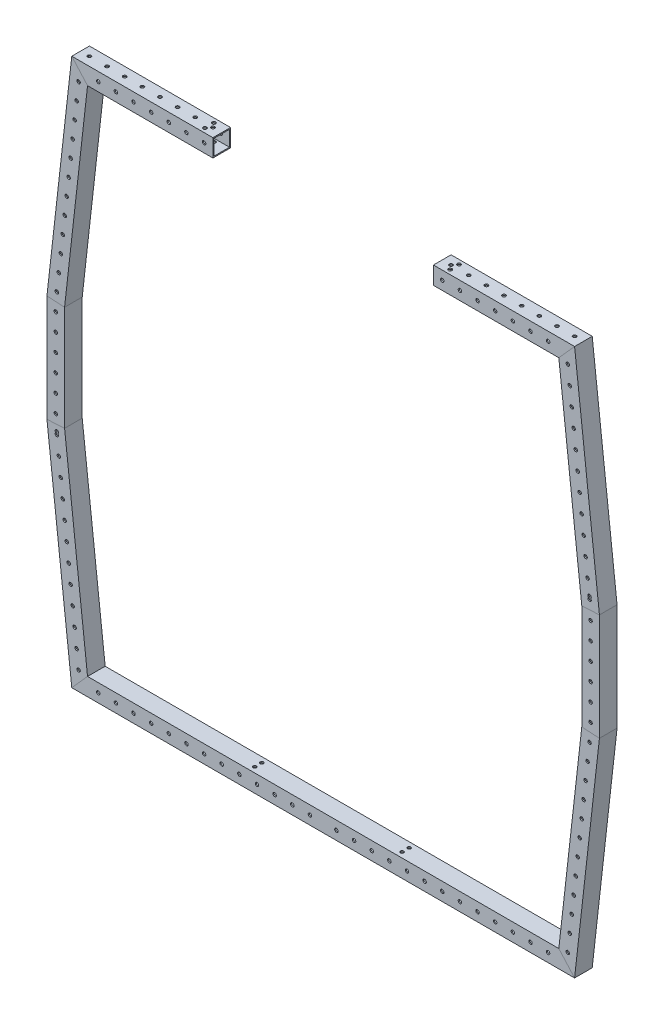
SolidWorks part; units mm, degrees
ref_plane "Front Plane" through (0, 0, 0) normal (0, 0, 1) x (1, 0, 0)
ref_plane "Top Plane" through (0, 0, 0) normal (0, 1, 0) x (1, 0, 0)
ref_plane "Right Plane" through (0, 0, 0) normal (1, 0, 0) x (0, 0, -1)
ref_plane "Plane2" through (0, 0, 25.4) normal (0, 0, 1) x (1, 0, 0)
sketch "Sketch2" plane through (0, 0, 25.4) normal (0, 0, 1) x (1, 0, 0)
  line L0 (-385.0161, -304.8) -> (-385.0161, -457.2)
  line L1 (385.0161, -304.8) -> (385.0161, -457.2)
  line L12 (-350.6032, -762) -> (350.6032, -762)
  line L13 (350.6032, -762) -> (393.6193, -381)
  line L14 (393.6193, -381) -> (350.6032, 0)
  line L15 (350.6032, 0) -> (-350.6032, 0)
  line L16 (-350.6032, 0) -> (-393.6193, -381)
  line L17 (-393.6193, -381) -> (-350.6032, -762)
  line L18 (-350.6032, -762) -> (350.6032, -762)
  line L19 (350.6032, -762) -> (385.0161, -457.2)
  line L20 (385.0161, -304.8) -> (350.6032, 0)
  line L21 (350.6032, 0) -> (-350.6032, 0)
  line L22 (-350.6032, 0) -> (-385.0161, -304.8)
  line L23 (-385.0161, -457.2) -> (-350.6032, -762)
  dimension "D2" = 152.4
  dimension "D1" = 12.7
sketch "Sketch13" plane through (0, 0, 0) normal (1, 0, 0) x (0, 0, -1)
  line L0 (-25.4, 0) -> (-25.4, -304.8) construction
  line L1 (-38.1, 12.7) -> (-12.7, 12.7)
  line L2 (-38.1, 12.7) -> (-38.1, -12.7)
  line L3 (-38.1, -12.7) -> (-12.7, -12.7)
  line L4 (-12.7, 12.7) -> (-12.7, -12.7)
  line L5 (-38.1, 12.7) -> (-12.7, -12.7) construction
  line L6 (-38.1, -12.7) -> (-12.7, 12.7) construction
  line L7 (-36.5125, 11.1125) -> (-14.2875, 11.1125)
  line L8 (-14.2875, 11.1125) -> (-14.2875, -11.1125)
  line L9 (-36.5125, -11.1125) -> (-14.2875, -11.1125)
  line L10 (-36.5125, 11.1125) -> (-36.5125, -11.1125)
  point P0 (-25.4, 0)
  dimension "D1" = 25.4
  dimension "D2" = 25.4
  dimension "D3" = 1.5875
sweep "Sweep1" add profiles "Sketch13" path "Sketch2"
sketch "Sketch14" plane through (0, 0, 38.1) normal (0, 0, 1) x (1, 0, 0)
  line L1 (-158.75, -620.3213) -> (158.75, -620.3213)
  line L2 (-158.75, -620.3213) -> (-158.75, 76.1802)
  line L3 (-158.75, 76.1802) -> (158.75, 76.1802)
  line L4 (158.75, -620.3213) -> (158.75, 76.1802)
  line L5 (-158.75, -620.3213) -> (158.75, 76.1802) construction
  line L6 (-158.75, 76.1802) -> (158.75, -620.3213) construction
  point P0 (0, -272.0706)
  dimension "D1" = 317.5
extrude "Cut-Extrude1" cut sketch "Sketch14" against normal through all
sketch "Sketch15" plane through (0, -774.7, 0) normal (0, -1, 0) x (1, 0, 0)
  line L0 (-361.95, 38.1) -> (-361.95, 12.7) construction
  line L1 (361.95, 38.1) -> (-361.95, 38.1) construction
  line L2 (0, 12.7) -> (0, 38.1) construction
  line L3 (361.95, 12.7) -> (-361.95, 12.7) construction
  circle A0 centre (-349.25, 25.4) radius 2.4892
  circle A1 centre (-323.85, 25.4) radius 2.4892
  circle A2 centre (-298.45, 25.4) radius 2.4892
  circle A3 centre (-273.05, 25.4) radius 2.4892
  circle A4 centre (-247.65, 25.4) radius 2.4892
  circle A5 centre (-222.25, 25.4) radius 2.4892
  circle A6 centre (-196.85, 25.4) radius 2.4892
  circle A7 centre (-171.45, 25.4) radius 2.4892
  circle A8 centre (-146.05, 25.4) radius 2.4892
  circle A9 centre (-120.65, 25.4) radius 2.4892
  circle A10 centre (-95.25, 25.4) radius 2.4892
  circle A11 centre (-69.85, 25.4) radius 2.4892
  circle A12 centre (-44.45, 25.4) radius 2.4892
  circle A13 centre (-19.05, 25.4) radius 2.4892
  circle A14 centre (19.05, 25.4) radius 2.4892
  circle A15 centre (44.45, 25.4) radius 2.4892
  circle A16 centre (69.85, 25.4) radius 2.4892
  circle A17 centre (95.25, 25.4) radius 2.4892
  circle A18 centre (120.65, 25.4) radius 2.4892
  circle A19 centre (146.05, 25.4) radius 2.4892
  circle A20 centre (171.45, 25.4) radius 2.4892
  circle A21 centre (196.85, 25.4) radius 2.4892
  circle A22 centre (222.25, 25.4) radius 2.4892
  circle A23 centre (247.65, 25.4) radius 2.4892
  circle A24 centre (273.05, 25.4) radius 2.4892
  circle A25 centre (298.45, 25.4) radius 2.4892
  circle A26 centre (323.85, 25.4) radius 2.4892
  circle A27 centre (349.25, 25.4) radius 2.4892
  point P36 (0, 12.7)
  dimension "D3" = 4.9784
  dimension "D1" = 12.7
  dimension "D2" = 12.7
  dimension "D5" = 25.4
  dimension "D4" = 14
extrude "Cut-Extrude2" cut sketch "Sketch15" against normal up to next (1.5875 mm away)
sketch "Sketch16" plane through (0, 12.7, 0) normal (0, 1, 0) x (1, 0, 0)
  line L0 (361.95, -12.7) -> (361.95, -38.1) construction
  line L1 (361.95, -38.1) -> (158.75, -38.1) construction
  line L2 (0, 0) -> (0, -38.1) construction
  circle A0 centre (349.25, -25.4) radius 2.4892
  circle A1 centre (323.85, -25.4) radius 2.4892
  circle A2 centre (298.45, -25.4) radius 2.4892
  circle A3 centre (273.05, -25.4) radius 2.4892
  circle A4 centre (247.65, -25.4) radius 2.4892
  circle A5 centre (222.25, -25.4) radius 2.4892
  circle A6 centre (196.85, -25.4) radius 2.4892
  circle A7 centre (171.45, -25.4) radius 2.4892
  circle A8 centre (-171.45, -25.4) radius 2.4892
  circle A9 centre (-196.85, -25.4) radius 2.4892
  circle A10 centre (-222.25, -25.4) radius 2.4892
  circle A11 centre (-247.65, -25.4) radius 2.4892
  circle A12 centre (-273.05, -25.4) radius 2.4892
  circle A13 centre (-298.45, -25.4) radius 2.4892
  circle A14 centre (-323.85, -25.4) radius 2.4892
  circle A15 centre (-349.25, -25.4) radius 2.4892
  dimension "D2" = 12.7
  dimension "D3" = 4.9784
  dimension "D1" = 12.7
  dimension "D5" = 25.4
  dimension "D4" = 8
extrude "Cut-Extrude3" cut sketch "Sketch16" against normal up to next
sketch "Sketch17" plane through (0, 0, 12.7) normal (0, 0, -1) x (-1, 0, 0)
  circle A3 centre (-383.5037, -287.8776) radius 2.4892
  circle A4 centre (-383.5037, -287.8776) radius 2.4892
  circle A7 centre (-383.5037, -470.1034) radius 2.4892
  circle A9 centre (383.5037, -466.0844) radius 2.4892 construction
  circle A13 centre (383.5037, -466.0844) radius 2.4892
  circle A15 centre (383.5037, -291.8966) radius 2.4892
  dimension "D2" = 4.9784
  dimension "D3" = 4.9784
  dimension "D1" = 0
extrude "Cut-Extrude4" cut sketch "Sketch17" against normal through all
sketch "Sketch18" plane through (0, 0, 38.1) normal (0, 0, 1) x (1, 0, 0)
  line L0 (-383.5037, -291.8966) -> (-386.3526, -317.1363) construction
  line L1 (-158.75, 12.7) -> (-158.75, -12.7) construction
  line L2 (0, 0) -> (0, -115.2191) construction
  line L3 (-372.3161, -381) -> (-298.45, -381) construction
  line L4 (383.5037, -291.8966) -> (386.3526, -317.1363) construction
  line L5 (383.5037, -470.1034) -> (386.3526, -444.8637) construction
  line L6 (0, -762) -> (0, -646.7809) construction
  line L7 (-383.5037, -470.1034) -> (-386.3526, -444.8637) construction
  line L8 (-372.3161, -305.5147) -> (-372.3161, -456.4853) construction
  circle A0 centre (-385.0161, -342.9) radius 2.4892
  circle A1 centre (-383.5037, -291.8966) radius 2.4892 construction
  circle A2 centre (-385.0161, -368.3) radius 2.4892
  circle A3 centre (-383.5037, -291.8966) radius 2.4892
  circle A4 centre (-380.654, -266.6569) radius 2.4892
  circle A5 centre (-377.8044, -241.4173) radius 2.4892
  circle A6 centre (-374.9548, -216.1776) radius 2.4892
  circle A7 centre (-372.1051, -190.938) radius 2.4892
  circle A8 centre (-369.2555, -165.6984) radius 2.4892
  circle A9 centre (-366.4058, -140.4587) radius 2.4892
  circle A10 centre (-363.5562, -115.2191) radius 2.4892
  circle A11 centre (-360.7066, -89.9794) radius 2.4892
  circle A12 centre (-357.8569, -64.7398) radius 2.4892
  circle A13 centre (-355.0073, -39.5001) radius 2.4892
  circle A14 centre (-352.1577, -14.2605) radius 2.4892
  circle A15 centre (-385.0161, -393.7) radius 2.4892
  circle A16 centre (-385.0161, -393.7) radius 2.4892
  circle A17 centre (-171.45, 0) radius 2.4892
  circle A18 centre (-196.85, 0) radius 2.4892
  circle A19 centre (-222.25, 0) radius 2.4892
  circle A20 centre (-247.65, 0) radius 2.4892
  circle A21 centre (-273.05, 0) radius 2.4892
  circle A22 centre (-298.45, 0) radius 2.4892
  circle A23 centre (-323.85, 0) radius 2.4892
  circle A24 centre (323.85, 0) radius 2.4892
  circle A25 centre (298.45, 0) radius 2.4892
  circle A26 centre (273.05, 0) radius 2.4892
  circle A27 centre (247.65, 0) radius 2.4892
  circle A28 centre (222.25, 0) radius 2.4892
  circle A29 centre (196.85, 0) radius 2.4892
  circle A30 centre (171.45, 0) radius 2.4892
  circle A31 centre (-385.0161, -419.1) radius 2.4892
  circle A32 centre (-385.0161, -419.1) radius 2.4892
  circle A33 centre (352.1577, -14.2605) radius 2.4892
  circle A34 centre (355.0073, -39.5001) radius 2.4892
  circle A35 centre (357.8569, -64.7398) radius 2.4892
  circle A36 centre (360.7066, -89.9794) radius 2.4892
  circle A37 centre (363.5562, -115.2191) radius 2.4892
  circle A38 centre (366.4058, -140.4587) radius 2.4892
  circle A39 centre (369.2555, -165.6984) radius 2.4892
  circle A40 centre (372.1051, -190.938) radius 2.4892
  circle A41 centre (374.9548, -216.1776) radius 2.4892
  circle A42 centre (377.8044, -241.4173) radius 2.4892
  circle A43 centre (380.654, -266.6569) radius 2.4892
  circle A44 centre (383.5037, -291.8966) radius 2.4892
  circle A45 centre (-385.0161, -444.5) radius 2.4892
  circle A46 centre (-385.0161, -317.5) radius 2.4892
  circle A47 centre (383.5037, -470.1034) radius 2.4892
  circle A48 centre (380.654, -495.3431) radius 2.4892
  circle A49 centre (377.8044, -520.5827) radius 2.4892
  circle A50 centre (374.9548, -545.8224) radius 2.4892
  circle A51 centre (372.1051, -571.062) radius 2.4892
  circle A52 centre (369.2555, -596.3016) radius 2.4892
  circle A53 centre (366.4058, -621.5413) radius 2.4892
  circle A54 centre (363.5562, -646.7809) radius 2.4892
  circle A55 centre (360.7066, -672.0206) radius 2.4892
  circle A56 centre (357.8569, -697.2602) radius 2.4892
  circle A57 centre (355.0073, -722.4999) radius 2.4892
  circle A58 centre (352.1577, -747.7395) radius 2.4892
  circle A59 centre (385.0161, -317.5) radius 2.4892
  circle A60 centre (385.0161, -444.5) radius 2.4892
  circle A61 centre (171.45, -762) radius 2.4892
  circle A62 centre (196.85, -762) radius 2.4892
  circle A63 centre (222.25, -762) radius 2.4892
  circle A64 centre (247.65, -762) radius 2.4892
  circle A65 centre (273.05, -762) radius 2.4892
  circle A66 centre (298.45, -762) radius 2.4892
  circle A67 centre (323.85, -762) radius 2.4892
  circle A68 centre (-323.85, -762) radius 2.4892
  circle A69 centre (-298.45, -762) radius 2.4892
  circle A70 centre (-273.05, -762) radius 2.4892
  circle A71 centre (-247.65, -762) radius 2.4892
  circle A72 centre (-222.25, -762) radius 2.4892
  circle A73 centre (-196.85, -762) radius 2.4892
  circle A74 centre (-171.45, -762) radius 2.4892
  circle A75 centre (385.0161, -419.1) radius 2.4892
  circle A76 centre (385.0161, -419.1) radius 2.4892
  circle A77 centre (-352.1577, -747.7395) radius 2.4892
  circle A78 centre (-355.0073, -722.4999) radius 2.4892
  circle A79 centre (-357.8569, -697.2602) radius 2.4892
  circle A80 centre (-360.7066, -672.0206) radius 2.4892
  circle A81 centre (-363.5562, -646.7809) radius 2.4892
  circle A82 centre (-366.4058, -621.5413) radius 2.4892
  circle A83 centre (-369.2555, -596.3016) radius 2.4892
  circle A84 centre (-372.1051, -571.062) radius 2.4892
  circle A85 centre (-374.9548, -545.8224) radius 2.4892
  circle A86 centre (-377.8044, -520.5827) radius 2.4892
  circle A87 centre (-380.654, -495.3431) radius 2.4892
  circle A88 centre (-383.5037, -470.1034) radius 2.4892
  circle A89 centre (385.0161, -393.7) radius 2.4892
  circle A90 centre (-146.05, -762) radius 2.4892
  circle A91 centre (-120.65, -762) radius 2.4892
  circle A92 centre (-95.25, -762) radius 2.4892
  circle A93 centre (-69.85, -762) radius 2.4892
  circle A94 centre (-44.45, -762) radius 2.4892
  circle A95 centre (-19.05, -762) radius 2.4892
  circle A96 centre (146.05, -762) radius 2.4892
  circle A97 centre (120.65, -762) radius 2.4892
  circle A98 centre (95.25, -762) radius 2.4892
  circle A99 centre (69.85, -762) radius 2.4892
  circle A100 centre (44.45, -762) radius 2.4892
  circle A101 centre (19.05, -762) radius 2.4892
  circle A102 centre (385.0161, -393.7) radius 2.4892
  circle A103 centre (385.0161, -368.3) radius 2.4892
  circle A104 centre (385.0161, -342.9) radius 2.4892
  dimension "D3" = 4.9784
  dimension "D10" = 4.9784
  dimension "D4" = 12.7
  dimension "D2" = 25.4
  dimension "D8" = 12.7
  dimension "D9" = 12.7
  dimension "D1" = 12
  dimension "D5" = 7
  dimension "D6" = 7
  dimension "D7" = 7
  dimension "D11" = 2
  dimension "D12" = 3
  dimension "D13" = 2
extrude "Cut-Extrude5" cut sketch "Sketch18" against normal through all
sketch "Sketch20" plane through (0, -12.7, 0) normal (0, -1, 0) x (1, 0, 0)
  line L1 (158.75, 12.7) -> (158.75, 38.1) construction
  line L2 (339.2564, 38.1) -> (158.75, 38.1) construction
  line L3 (339.2564, 12.7) -> (158.75, 12.7) construction
  line L4 (0, 104.958) -> (0, 38.1) construction
  line L5 (-361.95, 38.1) -> (361.95, 38.1) construction
  circle A0 centre (176.5376, 31.75) radius 2.5527
  circle A1 centre (176.5376, 19.05) radius 2.5527
  circle A2 centre (-176.5376, 31.75) radius 2.5527
  circle A3 centre (-176.5376, 19.05) radius 2.5527
  dimension "D2" = 5.1054
  dimension "D1" = 17.7876
  dimension "D3" = 6.35
  dimension "D4" = 6.35
extrude "Cut-Extrude6" cut sketch "Sketch20" against normal through all
sketch "Sketch21" plane through (0, -749.3, 0) normal (0, 1, 0) x (1, 0, 0)
  line L1 (-339.2564, -12.7) -> (339.2564, -12.7) construction
  line L2 (-339.2564, -38.1) -> (339.2564, -38.1) construction
  circle A0 centre (-106.0844, -30.48) radius 2.3813
  circle A1 centre (-106.0844, -20.32) radius 2.3813
  circle A2 centre (106.0056, -30.48) radius 2.3813
  circle A3 centre (106.0056, -20.32) radius 2.3813
  dimension "D4" = 4.7625
  dimension "D1" = 10.16
  dimension "D3" = 10.16
  dimension "D5" = 212.09
  dimension "D2" = 7.62
  dimension "D7" = 7.62
  dimension "D6" = 7.62
extrude "Cut-Extrude7" cut sketch "Sketch21" against normal up to next
